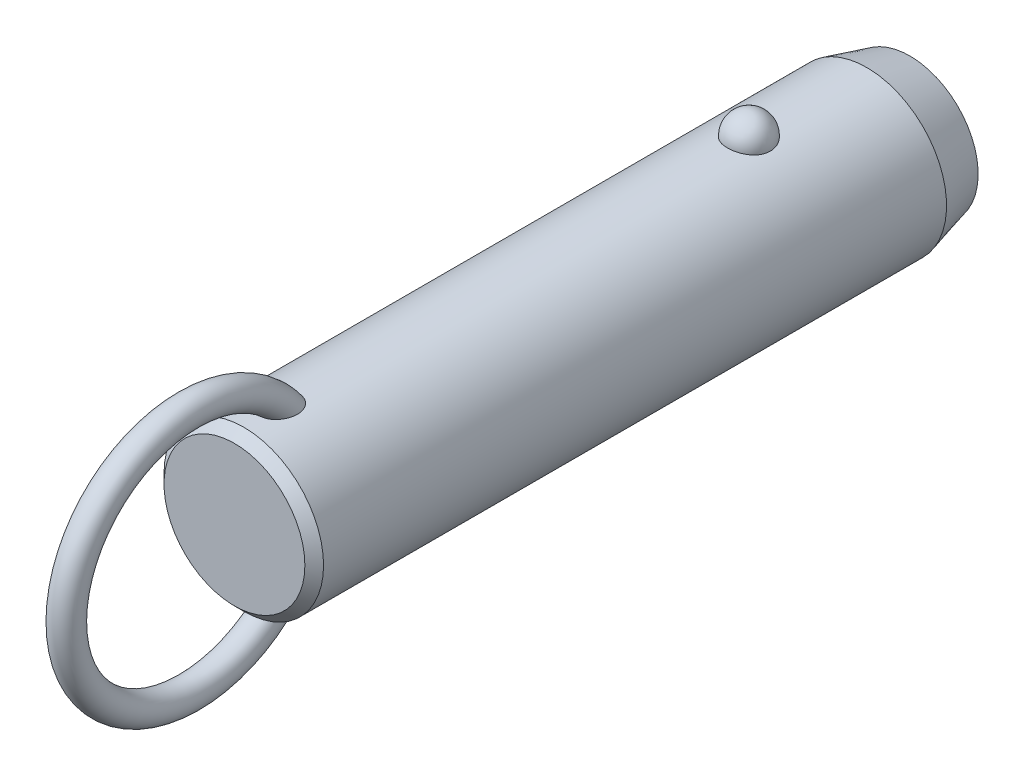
SolidWorks part; units mm, degrees
ref_plane "Front Plane" through (0, 0, 0) normal (0, 0, 1) x (1, 0, 0)
ref_plane "Top Plane" through (0, 0, 0) normal (0, 1, 0) x (1, 0, 0)
ref_plane "Right Plane" through (0, 0, 0) normal (1, 0, 0) x (0, 0, -1)
sketch "Sketch2" plane through (0, 0, 0) normal (0, 0, 1) x (1, 0, 0)
  circle A0 centre (0, 0) radius 11.1
  point P3 (0, 11.1)
  dimension "D1" = 22.2
extrude "Boss-Extrude1" add sketch "Sketch2" along normal blind 55.9
sketch "Sketch3" plane through (0, 0, 0) normal (0, 0, -1) x (-1, 0, 0)
  circle A0 centre (0, 0) radius 11.1
  dimension "D1" = 22.2
extrude "Boss-Extrude2" add sketch "Sketch3" along normal blind 25.4
chamfer "Chamfer1" distance 6 angle 15 1 edges at (-11.1, 0, -25.4)
sketch "Sketch12" plane through (0, 0, 0) normal (1, 0, 0) x (0, 0, -1)
  line L0 (-55.9, 11.1) -> (-55.9, -11.1) construction
  point P0 (-55.9, 0)
sketch "Sketch13" plane through (0, 0, 0) normal (1, 0, 0) x (0, 0, -1)
  circle A0 centre (-74.95, 0) radius 19.05
  point P2 (-55.9, 0)
  dimension "D1" = 38.1
sketch "Sketch14" plane through (0, 0, 0) normal (0, 1, 0) x (1, 0, 0)
  circle A0 centre (0, -57.9) radius 2
  point P2 (0, -55.9)
  dimension "D1" = 4
sweep "Sweep1" add profiles "Sketch14" path "Sketch13"
sketch "Sketch15" plane through (0, 0, 55.9) normal (0, 0, 1) x (1, 0, 0)
  circle A0 centre (0, 0) radius 11.1
  dimension "D1" = 22.2
extrude "Boss-Extrude3" add sketch "Sketch15" along normal blind 12.7
chamfer "Chamfer2" distance 1.3 angle 45 1 edges at (11.1, 0, 68.6)
sketch "Sketch18" plane through (0, 0, 0) normal (1, 0, 0) x (0, 0, -1)
  line L0 (19.4, 11.1) -> (-59.468, 11.1) construction
  line L1 (3, 14.1) -> (3, 8.1)
  line L2 (-59.468, -11.1) -> (19.4, -11.1) construction
  arc A0 (3, 14.1) -> (3, 8.1) centre (3, 11.1) ccw
  point P4 (0, 11.1)
  dimension "D1" = 25.2
revolve "Revolve1" add sketch "Sketch18" angle 360 about L1
